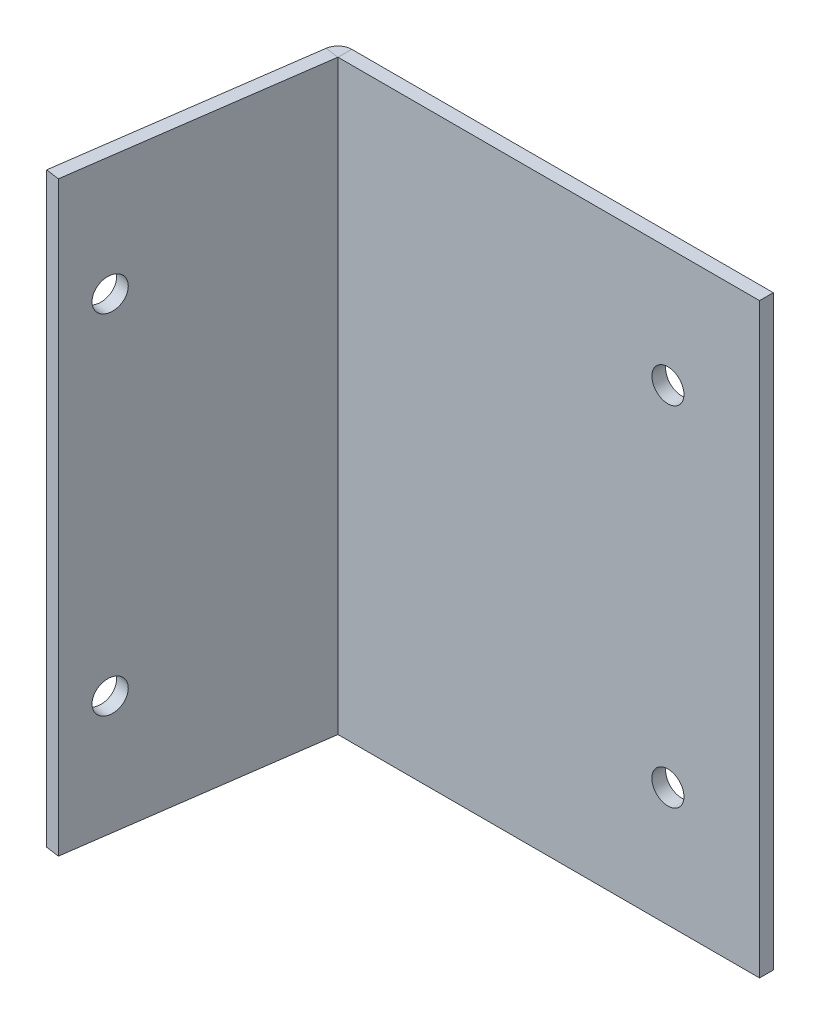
SolidWorks part; units mm, degrees
ref_plane "Front Plane" through (0, 0, 0) normal (0, 0, 1) x (1, 0, 0)
ref_plane "Top Plane" through (0, 0, 0) normal (0, 1, 0) x (1, 0, 0)
ref_plane "Right Plane" through (0, 0, 0) normal (1, 0, 0) x (0, 0, -1)
sketch "Sketch1" plane through (0, 0, 0) normal (0, 0, 1) x (1, 0, 0)
  line L0 (5, 51) -> (5, 13) construction
  line L1 (0, 0) -> (73, 0)
  line L2 (0, 0) -> (0, 64)
  line L3 (0, 64) -> (73, 64)
  line L4 (73, 0) -> (73, 64)
  line L5 (63, 51) -> (63, 13) construction
  line L6 (73, 32) -> (0, 32) construction
  circle A0 centre (5, 51) radius 1.75
  circle A1 centre (5, 13) radius 1.75
  circle A2 centre (63, 51) radius 1.75
  circle A3 centre (63, 13) radius 1.75
  dimension "D1" = 3.5
  dimension "D4" = 19
  dimension "D5" = 19
  dimension "D6" = 19
  dimension "D7" = 19
  dimension "D8" = 13
  dimension "D2" = 10
  dimension "D3" = 5
  dimension "D10" = 73
sheet metal parameters "Sheet-Metal1" thickness 1.5 parameters "D1"=1
base flange "Base-Flange1" sketch "Sketch1" thickness 1.5 reverse thickness direction yes parameters "D1"=1
sketch "Sketch3" plane through (0, 0, 1.5) normal (0, 0, 1) x (1, 0, 0)
  line L0 (27, 64) -> (27, 0)
  line L1 (73, 64) -> (0, 64) construction
  line L2 (0, 0) -> (73, 0) construction
  line L3 (0, 64) -> (0, 0) construction
  dimension "D1" = 27
sketched bend "Sketched Bend1" parameters "D1"=0.01
bend "SketchBend1" bend radius 0.01 bend angle 82 parameters "D5"=1
flat pattern "Flat-Pattern1"
sketch "Bend-Lines1" plane through (0, 0, 0) normal (0, 1, 0) x (-1, 0, 0)
bend of the flat pattern "Flatten-<SketchBend1>1"
